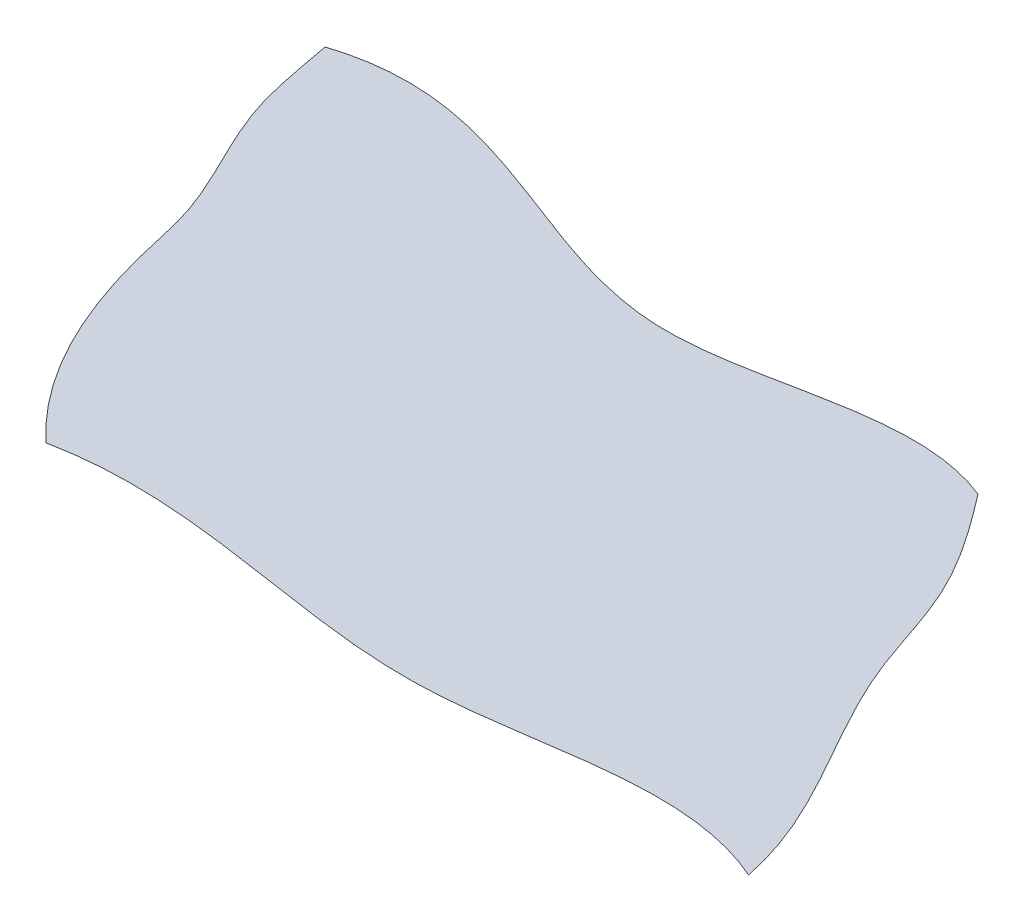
SolidWorks part; units mm, degrees
ref_plane "Front Plane" through (0, 0, 0) normal (0, 0, 1) x (1, 0, 0)
ref_plane "Top Plane" through (0, 0, 0) normal (0, 1, 0) x (1, 0, 0)
ref_plane "Right Plane" through (0, 0, 0) normal (1, 0, 0) x (0, 0, -1)
sketch "Sketch1" plane through (0, 0, 0) normal (0, 1, 0) x (1, 0, 0)
  spline S0 degree 3 poles (-66.8128, 3.8376) (-44.4007, 8.2889) (-4.0558, -8.2342) (36.2598, 7.9217) (54.287, 0) knots 0 0 0 0 0.550374 1 1 1 1
  spline S1 degree 3 poles (-100.7361, 84.3387) (-76.5118, 92.3274) (-39.5825, 57.9825) (1.5594, 81.0171) (18.3738, 74.202) knots 0 0 0 0 0.576263 1 1 1 1
  spline S2 degree 3 poles (-66.8128, 3.8376) (-77.2937, 13.6248) (-84.2043, 29.2508) (-88.9364, 53.2424) (-103.0126, 74.3419) (-99.8402, 98.2285) (-113.3346, 108.2398) knots 0 0 0 0 0.361721 0.433484 0.634003 1 1 1 1
  spline S3 degree 3 poles (54.287, 0) (51.3037, 14.8894) (37.3838, 31.1446) (27.6472, 68.1535) (7.8616, 83.8333) (2.0401, 99.9802) knots 0 0 0 0 0.391601 0.545827 1 1 1 1
  spline S4 degree 3 poles (-88.2513, 48.2796) (-65.1291, 37.5873) (-23.0228, 41.3792) (18.465, 39.9693) (35.7596, 40.2445) knots 0 0 0 0 0.585603 1 1 1 1
  spline S5 degree 3 poles (0, 0) (-8.5776, 12.1235) (-11.324, 33.1809) (-27.7693, 62.8632) (-37.1803, 79.6755) (-41.4855, 92.2905) knots 0 0 0 0 0.427909 0.608963 1 1 1 1
other "Boundary-Surface1"
